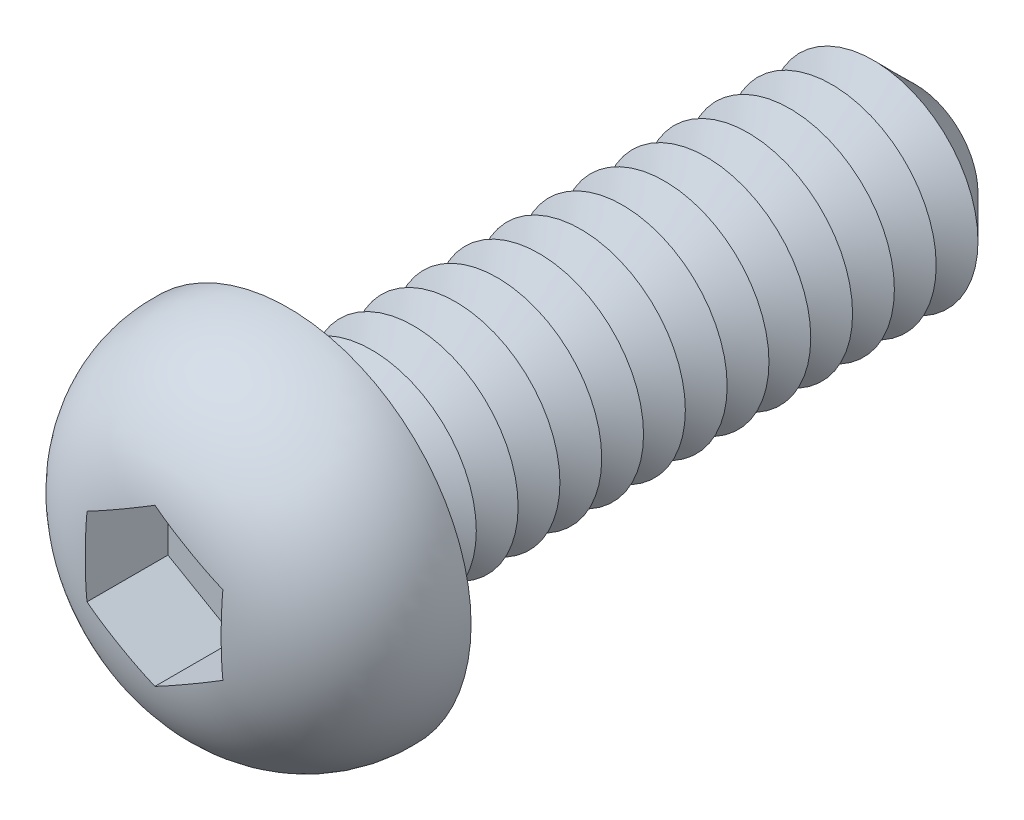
SolidWorks part; units mm, degrees
ref_plane "Front Plane" through (0, 0, 0) normal (0, 0, 1) x (1, 0, 0)
ref_plane "Top Plane" through (0, 0, 0) normal (0, 1, 0) x (1, 0, 0)
ref_plane "Right Plane" through (0, 0, 0) normal (1, 0, 0) x (0, 0, -1)
sketch "Sketch1" plane through (0, 0, 0) normal (1, 0, 0) x (0, 0, -1)
  line L0 (-47.9342, 0) -> (60.3146, 0) construction
sketch "Sketch2" plane through (0, 0, 0) normal (1, 0, 0) x (0, 0, -1)
  line L0 (0, 0) -> (-1.3, 0)
  line L1 (-47.9342, 0) -> (60.3146, 0) construction
  line L2 (-1.3, 0) -> (-1.3, 0.501)
  line L3 (0, 1.75) -> (0, 0)
  arc A0 (-1.3, 0.501) -> (0, 1.75) centre (-0.05, 0.501) cw
  dimension "D1" = 1.25
  dimension "D2" = 1.3
  dimension "D3" = 1.75
revolve "Revolve1" add sketch "Sketch2" angle 360 about L0
sketch "Sketch3" plane through (0, 0, 1.3) normal (0, 0, 1) x (1, 0, 0)
  line L1 (0, 0.7506) -> (-0.65, 0.3753)
  line L2 (-0.65, 0.3753) -> (-0.65, -0.3753)
  line L3 (-0.65, -0.3753) -> (0, -0.7506)
  line L4 (0, -0.7506) -> (0.65, -0.3753)
  line L5 (0.65, -0.3753) -> (0.65, 0.3753)
  line L6 (0.65, 0.3753) -> (0, 0.7506)
  circle A0 centre (0, 0) radius 0.65 construction
  dimension "D1" = 1.3
extrude "Cut-Extrude1" cut sketch "Sketch3" against normal blind 0.8
sketch "Sketch4" plane through (0, 0, 0) normal (0, 0, -1) x (-1, 0, 0)
  circle A0 centre (0, 0) radius 1
  dimension "D1" = 2
extrude "Boss-Extrude1" add sketch "Sketch4" along normal blind 6
chamfer "Chamfer1" distance 0.4 angle 45 1 edges at (-1, 0, -6)
sketch "Sketch5" plane through (0, 0, 0) normal (1, 0, 0) x (0, 0, -1)
  line L0 (0.4, 1) -> (0.8, 1)
  line L1 (5.6, 1) -> (0, 1) construction
  line L2 (0.8, 1) -> (0.6, 0.6536)
  line L3 (0.6, 0.6536) -> (0.4, 1)
  line L4 (0, -1.75) -> (0, 1.75) construction
  line L5 (5.6, 1) -> (0, 1) construction
  dimension "D1" = 0.4
  dimension "D2" = 0.4
revolve "Cut-Revolve1" cut sketch "Sketch5" angle 360 about L0
pattern_linear "LPattern1" count 13 spacing 0.4 along (0, 0, -1) of "Cut-Revolve1"
fillet "Fillet2" radius 0.2 1 edges at (-1, 0, 0)
sketch "Sketch6" plane through (0, 0, 0.5) normal (0, 0, 1) x (1, 0, 0)
  circle A0 centre (0, 0) radius 0.35
  dimension "D1" = 0.7
extrude "Cut-Extrude2" cut sketch "Sketch6" against normal up to surface (6.5 mm away)
